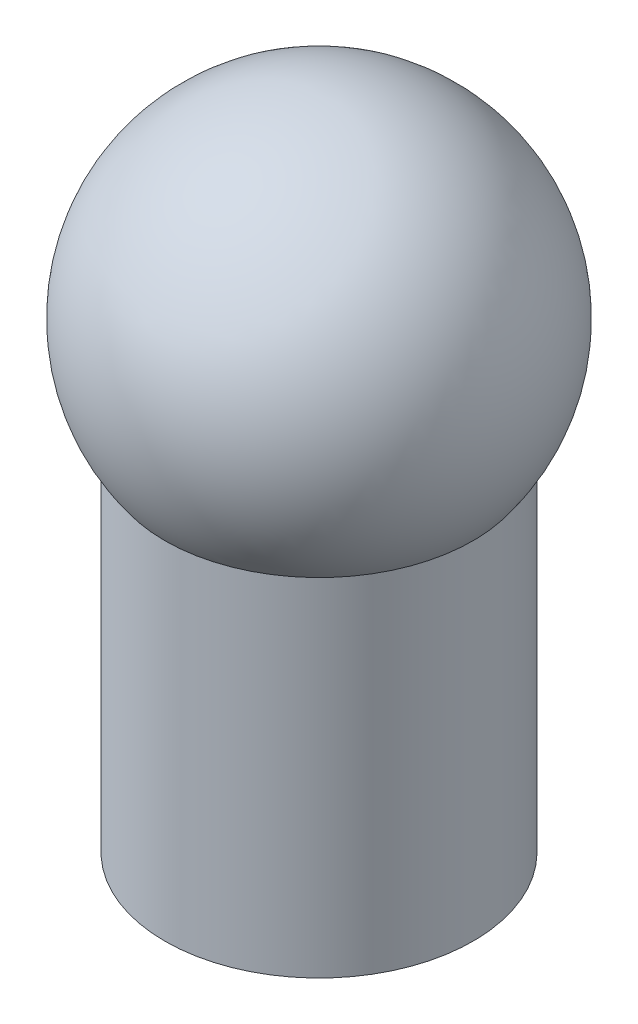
SolidWorks part; units mm, degrees
ref_plane "Alzado" through (0, 0, 0) normal (0, 0, 1) x (1, 0, 0)
ref_plane "Planta" through (0, 0, 0) normal (0, 1, 0) x (1, 0, 0)
ref_plane "Vista lateral" through (0, 0, 0) normal (1, 0, 0) x (0, 0, -1)
sketch "Croquis2" plane through (0, 0, 0) normal (0, 1, 0) x (1, 0, 0)
  line L0 (0, 5) -> (0, -5)
  arc A0 (0, -5) -> (0, 5) centre (0, 0) ccw
  point P5 (0, 0)
  dimension "D1" = 10
revolve "Revolución1" add sketch "Croquis2" angle 360 about L0
sketch "Croquis3" plane through (0, 0, 0) normal (0, 1, 0) x (1, 0, 0)
  circle A0 centre (0, 0) radius 4
  dimension "D1" = 8
extrude "Saliente-Extruir1" add sketch "Croquis3" against normal blind 12
sketch "Croquis4" plane through (0, 0, 0) normal (0, 0, 1) x (1, 0, 0)
  circle A0 centre (0, 0) radius 4
  dimension "D1" = 8
